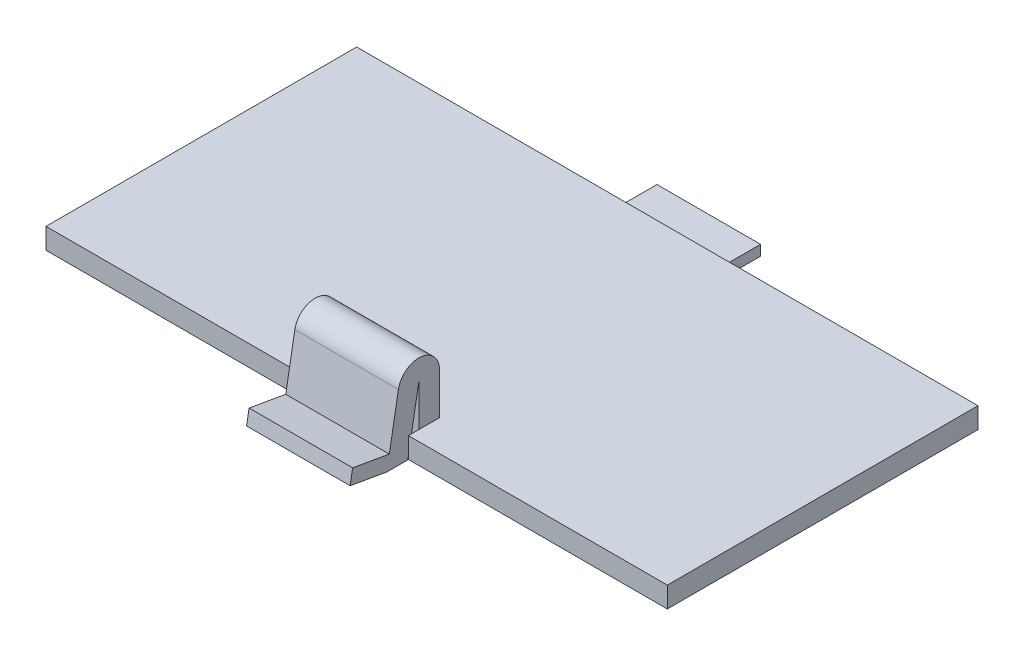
SolidWorks part; units mm, degrees
ref_plane "Front Plane" through (0, 0, 0) normal (0, 0, 1) x (1, 0, 0)
ref_plane "Top Plane" through (0, 0, 0) normal (0, 1, 0) x (1, 0, 0)
ref_plane "Right Plane" through (0, 0, 0) normal (1, 0, 0) x (0, 0, -1)
sketch "Sketch1" plane through (0, 0, 0) normal (0, 1, 0) x (1, 0, 0)
  line L1 (-137.7551, -49.2857) -> (-107.7551, -49.2857)
  line L2 (-137.7551, -49.2857) -> (-137.7551, -64.2857)
  line L3 (-137.7551, -64.2857) -> (-107.7551, -64.2857)
  line L4 (-107.7551, -49.2857) -> (-107.7551, -64.2857)
  dimension "D1" = 15
  dimension "D2" = 30
extrude "Boss-Extrude1" add sketch "Sketch1" along normal blind 1
sketch "Sketch2" plane through (0, 0, 49.2857) normal (0, 0, -1) x (-1, 0, 0)
  line L0 (122.7551, 6.9685) -> (122.7551, -6.4685) construction
  line L2 (107.7551, 1) -> (107.7551, 0) construction
  line L3 (137.7551, 1) -> (137.7551, 0) construction
  line L4 (107.7551, 0) -> (137.7551, 0) construction
  line L5 (120.2551, 0.5) -> (125.2551, 0.5)
  line L6 (120.2551, 0.5) -> (120.2551, 0)
  line L7 (120.2551, 0) -> (125.2551, 0)
  line L8 (125.2551, 0.5) -> (125.2551, 0)
  line L9 (120.2551, 0.5) -> (125.2551, 0) construction
  line L10 (120.2551, 0) -> (125.2551, 0.5) construction
  point P2 (122.7551, 0.25)
  dimension "D1" = 5
  dimension "0.5mm" = 0.5
extrude "Boss-Extrude4" add sketch "Sketch2" along normal blind 2 contours L6 L5 L8 L7
sketch "Sketch4" plane through (0, 1, 0) normal (0, 1, 0) x (1, 0, 0)
  line L0 (-122.7551, -44.6425) -> (-122.7551, -69.35) construction
  line L1 (-137.7551, -49.2857) -> (-137.7551, -64.2857) construction
  line L2 (-107.7551, -64.2857) -> (-107.7551, -49.2857) construction
  line L4 (-125.2551, -62.7857) -> (-120.2551, -62.7857)
  line L5 (-125.2551, -62.7857) -> (-125.2551, -63.7857)
  line L6 (-125.2551, -63.7857) -> (-120.2551, -63.7857)
  line L7 (-120.2551, -62.7857) -> (-120.2551, -63.7857)
  line L8 (-125.2551, -62.7857) -> (-120.2551, -63.7857) construction
  line L9 (-125.2551, -63.7857) -> (-120.2551, -62.7857) construction
  line L11 (-137.7551, -64.2857) -> (-107.7551, -64.2857) construction
  point P6 (-122.7551, -63.2857)
  point P11 (-120.2551, -63.2857)
  dimension "D1" = 5
  dimension "D2" = 1
  dimension "D3" = 0.5
extrude "Boss-Extrude5" add sketch "Sketch4" along normal blind 2
ref_plane "Plane1" through (0, 3, 0) normal (0, 1, 0) x (1, 0, 0)
sketch "Sketch5" plane through (0, 3, 0) normal (0, 1, 0) x (1, 0, 0)
  line L0 (-130.6613, -63.7857) -> (-115.7495, -63.7857) construction
  line L1 (-125.2551, -63.7857) -> (-120.2551, -63.7857)
  line L2 (-125.2551, -63.7857) -> (-125.2551, -62.7857)
  line L3 (-125.2551, -62.7857) -> (-120.2551, -62.7857)
  line L4 (-120.2551, -63.7857) -> (-120.2551, -62.7857)
  point P8 (-130.6613, -63.7857)
  point P9 (-115.7495, -63.7857)
revolve "Revolve1" add sketch "Sketch5" angle 170 about L0
sketch "Sketch6" plane through (0, 1, 0) normal (0, 1, 0) x (1, 0, 0)
  line L0 (-137.7551, -64.2857) -> (-107.7551, -64.2857) construction
  line L1 (-125.2551, -63.7857) -> (-120.2551, -63.7857)
  line L2 (-125.2551, -63.7857) -> (-125.2551, -64.2857)
  line L3 (-125.2551, -64.2857) -> (-120.2551, -64.2857)
  line L4 (-120.2551, -63.7857) -> (-120.2551, -64.2857)
  line L5 (-125.2551, -62.7857) -> (-125.2551, -63.7857) construction
  line L6 (-120.2551, -63.7857) -> (-120.2551, -62.7857) construction
extrude "Cut-Extrude2" cut sketch "Sketch6" against normal blind 2 contours L2 L1 L4 L3
ref_plane "Plane2" through (0, -7.9985, 1.4103) normal (0, -0.9848, 0.1736) x (-1, 0, 0)
sketch "Sketch7" plane through (0, -7.9985, 1.4103) normal (0, -0.9848, 0.1736) x (-1, 0, 0)
  line L1 (125.2551, -64.3376) -> (120.2551, -64.3376)
  line L2 (125.2551, -64.3376) -> (125.2551, -63.3376)
  line L3 (125.2551, -63.3376) -> (120.2551, -63.3376)
  line L4 (120.2551, -64.3376) -> (120.2551, -63.3376)
extrude "Boss-Extrude6" add sketch "Sketch7" along normal blind 4
ref_plane "Plane3" through (0, 0, 47.2857) normal (0, 0, -1) x (-1, 0, 0)
sketch "Sketch8" plane through (0, 0, 47.2857) normal (0, 0, -1) x (-1, 0, 0)
  line L1 (120.2551, 0) -> (125.6148, 0)
  line L2 (120.2551, 0) -> (120.2551, -3.7819)
  line L3 (120.2551, -3.7819) -> (125.6148, -3.7819)
  line L4 (125.6148, 0) -> (125.6148, -3.7819)
  point P5 (120.2551, -3.3101)
  point P6 (125.6148, -3.7819)
extrude "Cut-Extrude3" cut sketch "Sketch8" against normal blind 50
ref_plane "Plane6" through (0, 11.1721, 63.3602) normal (0, 0.1736, 0.9848) x (1, 0, 0)
sketch "Sketch11" plane through (0, 11.1721, 63.3602) normal (0, 0.1736, 0.9848) x (1, 0, 0)
  line L0 (-120.2551, -11.3445) -> (-120.2551, -8.1218) construction
  line L1 (-125.2551, -11.3445) -> (-120.2551, -11.3445)
  line L2 (-125.2551, -11.3445) -> (-125.2551, -10.6445)
  line L3 (-125.2551, -10.6445) -> (-120.2551, -10.6445)
  line L4 (-120.2551, -11.3445) -> (-120.2551, -10.6445)
  dimension "D1" = 0.7
extrude "Boss-Extrude12" add sketch "Sketch11" along normal blind 1.8 contours L2 L1 L4 L3
